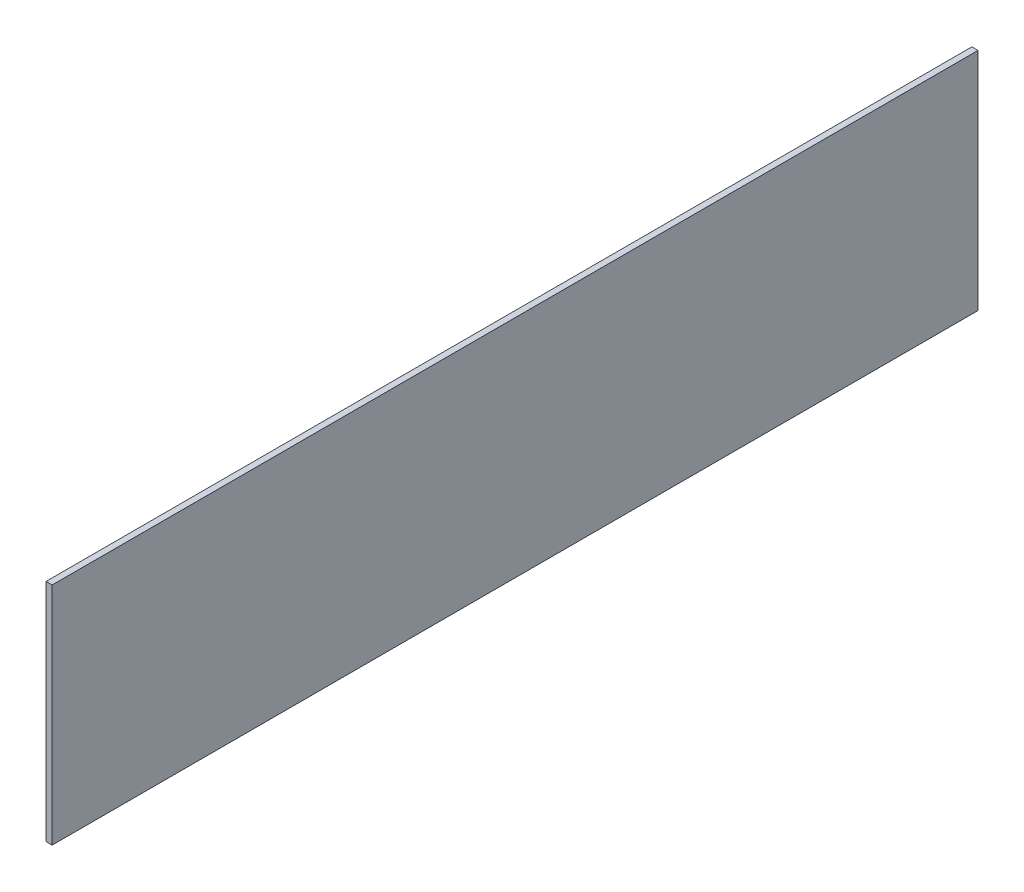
SolidWorks part; units mm, degrees
ref_plane "Alzado" through (0, 0, 0) normal (0, 0, 1) x (1, 0, 0)
ref_plane "Planta" through (0, 0, 0) normal (0, 1, 0) x (1, 0, 0)
ref_plane "Vista lateral" through (0, 0, 0) normal (1, 0, 0) x (0, 0, -1)
sketch "Sketch1" plane through (0, 0, 0) normal (1, 0, 0) x (0, 0, -1)
  line L1 (0, 0) -> (452, 0)
  line L2 (0, 0) -> (0, 110)
  line L3 (0, 110) -> (452, 110)
  line L4 (452, 0) -> (452, 110)
  dimension "D1" = 452
  dimension "D2" = 110
extrude "Boss-Extrude1" add sketch "Sketch1" along normal blind 3
